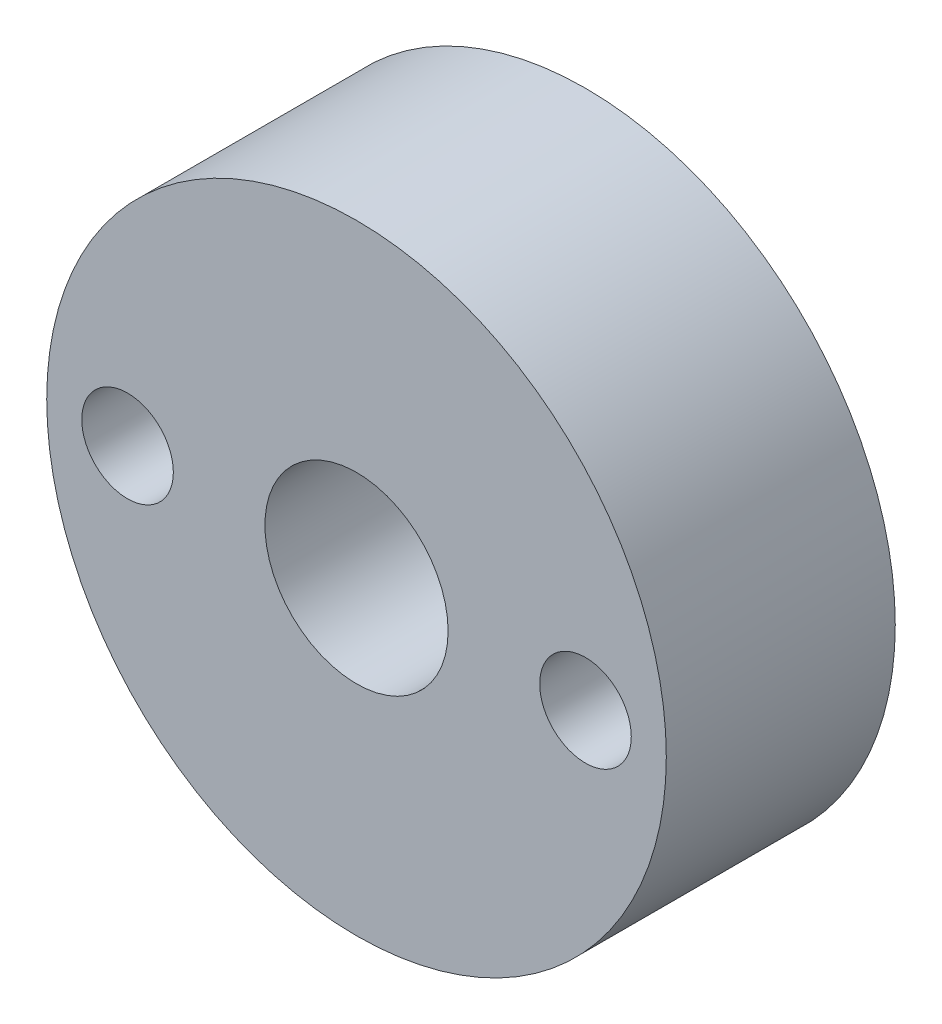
SolidWorks part; units mm, degrees
ref_plane "Front Plane" through (0, 0, 0) normal (0, 0, 1) x (1, 0, 0)
ref_plane "Top Plane" through (0, 0, 0) normal (0, 1, 0) x (1, 0, 0)
ref_plane "Right Plane" through (0, 0, 0) normal (1, 0, 0) x (0, 0, -1)
sketch "Sketch1" plane through (0, 0, 0) normal (0, 0, 1) x (1, 0, 0)
  circle A0 centre (0, 0) radius 6.765
extrude "Boss-Extrude1" add sketch "Sketch1" along normal blind 5
sketch "Sketch2" plane through (0, 0, 5) normal (0, 0, 1) x (1, 0, 0)
  circle A0 centre (0, 0) radius 2
  circle A1 centre (5, 0) radius 1
  circle A2 centre (-5, 0) radius 1
  dimension "D1" = 5
  dimension "D2" = 5
extrude "Cut-Extrude1" cut sketch "Sketch2" against normal blind 5
